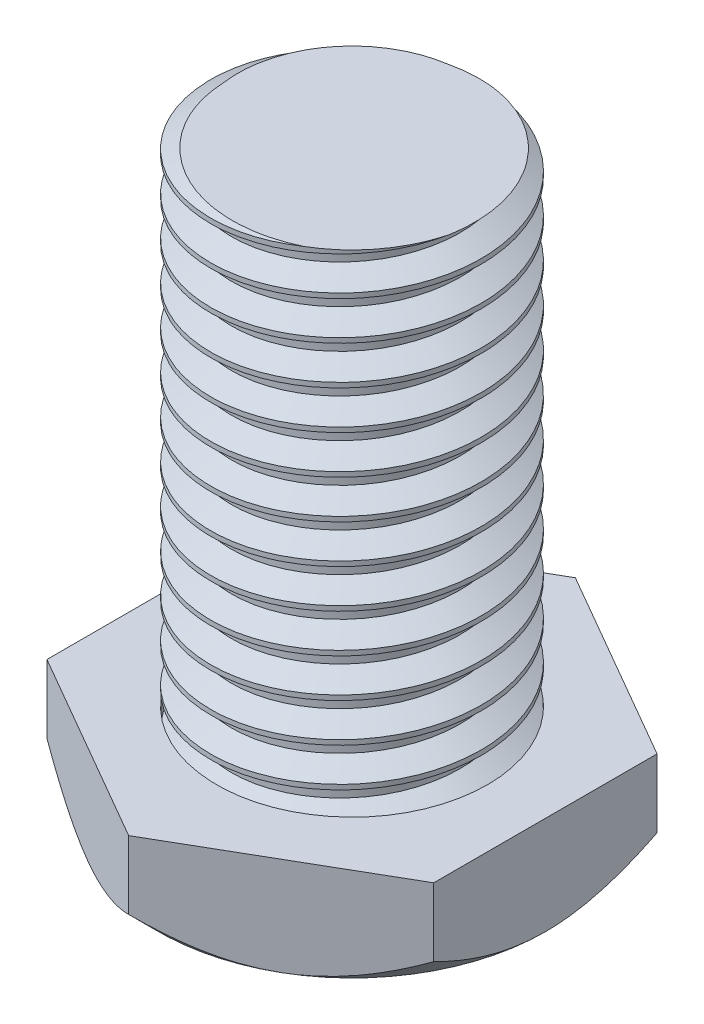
SolidWorks part; units mm, degrees
ref_plane "Front Plane" through (0, 0, 0) normal (0, 0, 1) x (1, 0, 0)
ref_plane "Top Plane" through (0, 0, 0) normal (0, 1, 0) x (1, 0, 0)
ref_plane "Right Plane" through (0, 0, 0) normal (1, 0, 0) x (0, 0, -1)
sketch "Sketch1" plane through (0, 0, 0) normal (0, 1, 0) x (1, 0, 0)
  line L1 (5, 2.8868) -> (0, 5.7735)
  line L2 (0, 5.7735) -> (-5, 2.8868)
  line L3 (-5, 2.8868) -> (-5, -2.8868)
  line L4 (-5, -2.8868) -> (0, -5.7735)
  line L5 (0, -5.7735) -> (5, -2.8868)
  line L6 (5, -2.8868) -> (5, 2.8868)
  circle A0 centre (0, 0) radius 5 construction
  circle A1 centre (0, 0) radius 3.5
  dimension "D2" = 7
  dimension "D1" = 10
extrude "Boss-Extrude1" add sketch "Sketch1" along normal mid plane 2.54 contours L1 L2 L3 L4 L5 L6
sketch "Sketch2" plane through (0, 1.27, 0) normal (0, 1, 0) x (1, 0, 0)
  circle A0 centre (0, 0) radius 3.5
  dimension "D1" = 7
extrude "Boss-Extrude2" add sketch "Sketch2" along normal blind 12.7
thread "Thread1" pitch 1 start angle 0, offset 2.54, length 0, pitch 1, diameter 7
ref_plane "Plane1" through (-3.5, 16.51, 0) normal (0, 0, 1) x (-1, 0, 0)
sketch "Thread Profile1" plane through (-3.5, 16.51, 0) normal (0, 0, 1) x (-1, 0, 0)
  line L0 (0, 0) -> (0, 1) construction
  line L11 (0, 0) -> (0, 0.875)
  line L12 (0, 0.875) -> (-0.5413, 0.5625)
  line L13 (-0.5413, 0.5625) -> (-0.5413, 0.3125)
  line L15 (-0.5413, 0.3125) -> (0, 0)
  line L17 (-0.5413, 0.4375) -> (0, 0.4375) construction
  point P2 (0, 0)
  dimension "Pitch" = 1
  dimension "Profile_Angle" = 60
  dimension "Profile_Land" = 0.25
  dimension "Profile_Height" = 0.5413
sketch "Sketch16" plane through (0, -1.27, 0) normal (0, -1, 0) x (1, 0, 0)
  circle A0 centre (0, 0) radius 5
  dimension "D1" = 10
extrude "Cut-Extrude1" cut sketch "Sketch16" against normal mid plane 2.54 draft 45 flip side to cut
